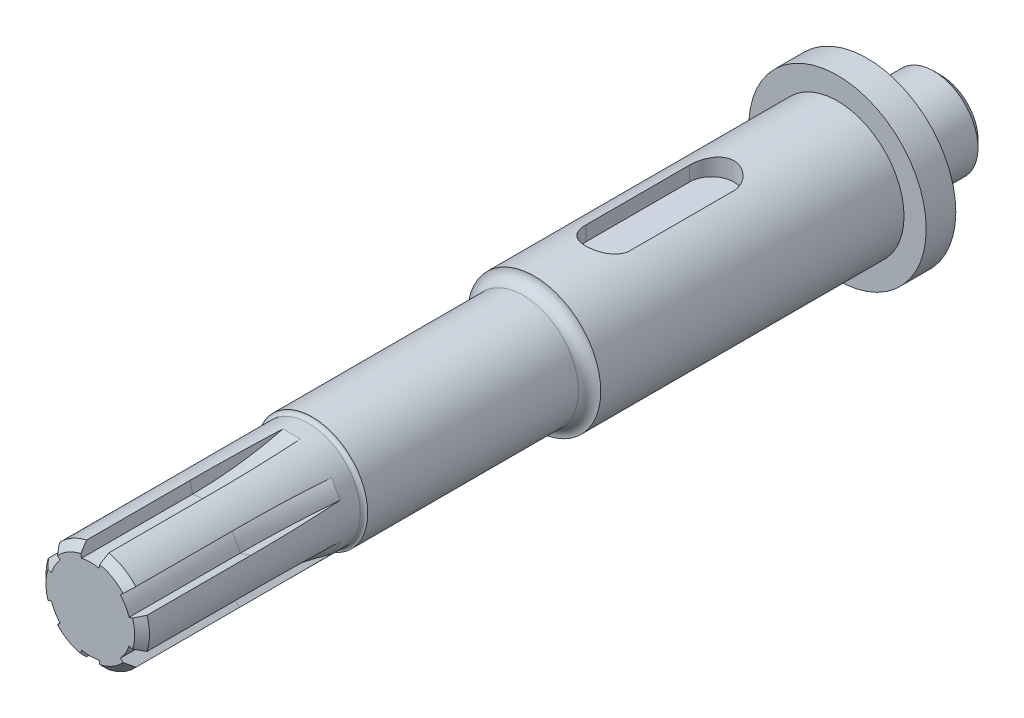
SolidWorks part; units mm, degrees
ref_plane "Ön Düzlem" through (0, 0, 0) normal (0, 0, 1) x (1, 0, 0)
ref_plane "Üst Düzlem" through (0, 0, 0) normal (0, 1, 0) x (1, 0, 0)
ref_plane "Sağ Düzlem" through (0, 0, 0) normal (1, 0, 0) x (0, 0, -1)
sketch "Sketch1" plane through (0, 0, 0) normal (0, 0, 1) x (1, 0, 0)
  circle A0 centre (0, 0) radius 6
  dimension "D1" = 12
extrude "Boss-Extrude1" add sketch "Sketch1" along normal blind 10
sketch "Sketch2" plane through (0, 0, 10) normal (0, 0, 1) x (1, 0, 0)
  circle A0 centre (0, 0) radius 12
  dimension "D1" = 24
extrude "Boss-Extrude2" add sketch "Sketch2" along normal blind 4
sketch "Sketch3" plane through (0, 0, 14) normal (0, 0, 1) x (1, 0, 0)
  circle A0 centre (0, 0) radius 9
  dimension "D1" = 18
extrude "Boss-Extrude3" add sketch "Sketch3" along normal blind 41
sketch "Sketch4" plane through (0, 0, 55) normal (0, 0, 1) x (1, 0, 0)
  circle A0 centre (0, 0) radius 7.5
  dimension "D1" = 15
extrude "Boss-Extrude4" add sketch "Sketch4" along normal blind 30
sketch "Sketch5" plane through (0, 0, 85) normal (0, 0, 1) x (1, 0, 0)
  circle A0 centre (0, 0) radius 7
  dimension "D1" = 14
extrude "Boss-Extrude5" add sketch "Sketch5" along normal blind 30
sketch "Sketch21" plane through (16.4159, 1.5666, 55) normal (0, 0, 1) x (1, 0, 0)
  line L0 (-16.4159, 7.4334) -> (-16.4159, -1.5666) construction
  line L1 (-16.4159, -1.5666) -> (-16.4159, 7.4334) construction
  circle A0 centre (-16.4159, -1.5666) radius 9 construction
  circle A2 centre (-16.4159, -1.5666) radius 9
  dimension "Angle from vertical" = 360
ref_plane "Plane1" through (0, 9, 55) normal (0, -1, 0) x (-1, 0, 0)
sketch "Sketch31" plane through (-8.2079, 9, 55) normal (0, -1, 0) x (0, 0, 1)
  line L0 (-10, -8.2079) -> (-24, -8.2079) construction
  line L1 (-10, -5.2079) -> (-24, -5.2079)
  line L2 (-10, -11.2079) -> (-24, -11.2079)
  arc A0 (-10, -5.2079) -> (-10, -11.2079) centre (-10, -8.2079) cw
  arc A1 (-24, -5.2079) -> (-24, -11.2079) centre (-24, -8.2079) ccw
  dimension "Keyway width" = 6
  dimension "Distance from end face" = 10
  dimension "Length of slot" = 14
extrude "Cut-Extrude1" cut sketch "Sketch31" along normal blind 2.5
other "keyway (bs 4235 - part i)<1>"
sketch "Sketch34" plane through (0, 0, 0) normal (1, 0, 0) x (0, 0, -1)
  line L0 (-115, 5.5) -> (-100, 5.5)
  line L1 (-115, 7) -> (-115, -7) construction
  line L2 (-85, 7) -> (-115, 7) construction
  arc A0 (-100, 5.5) -> (-87.8448, 7) centre (-100, 55.5) ccw
  dimension "D2" = 50
  dimension "D1" = 15
  dimension "D3" = 1.5
sketch "Sketch35" plane through (0, 0, 115) normal (0, 0, 1) x (1, 0, 0)
  line L0 (0, 0) -> (0, 7) construction
  line L1 (1.1786, 5.3722) -> (1.5, 6.8374)
  line L2 (-1.1786, 5.3722) -> (-1.5, 6.8374)
  arc A0 (1.1786, 5.3722) -> (-1.1786, 5.3722) centre (0, 0) ccw
  circle A1 centre (0, 0) radius 7
  arc A2 (1.5, 6.8374) -> (-1.5, 6.8374) centre (0, 0) ccw
  dimension "D2" = 11
  dimension "D3" = 3
  dimension "D4" = 1.1786
  dimension "D1" = 0
fillet "Fillet3" radius 1.5 1 edges at (7.5, 0, 55)
fillet "Fillet4" radius 0.5 1 edges at (7, 0, 85)
sweep "Cut-Sweep1" cut profiles "Sketch35" path "Sketch34"
pattern_circular "CirPattern8" count 6 over 360 about axis through (0, 0, 115) along (0, 0, -1) of "Cut-Sweep1"
chamfer "Chamfer2" distance 1 angle 45 6 edges
chamfer "Chamfer3" distance 1 angle 45 1 edges at (6, 0, 0)
